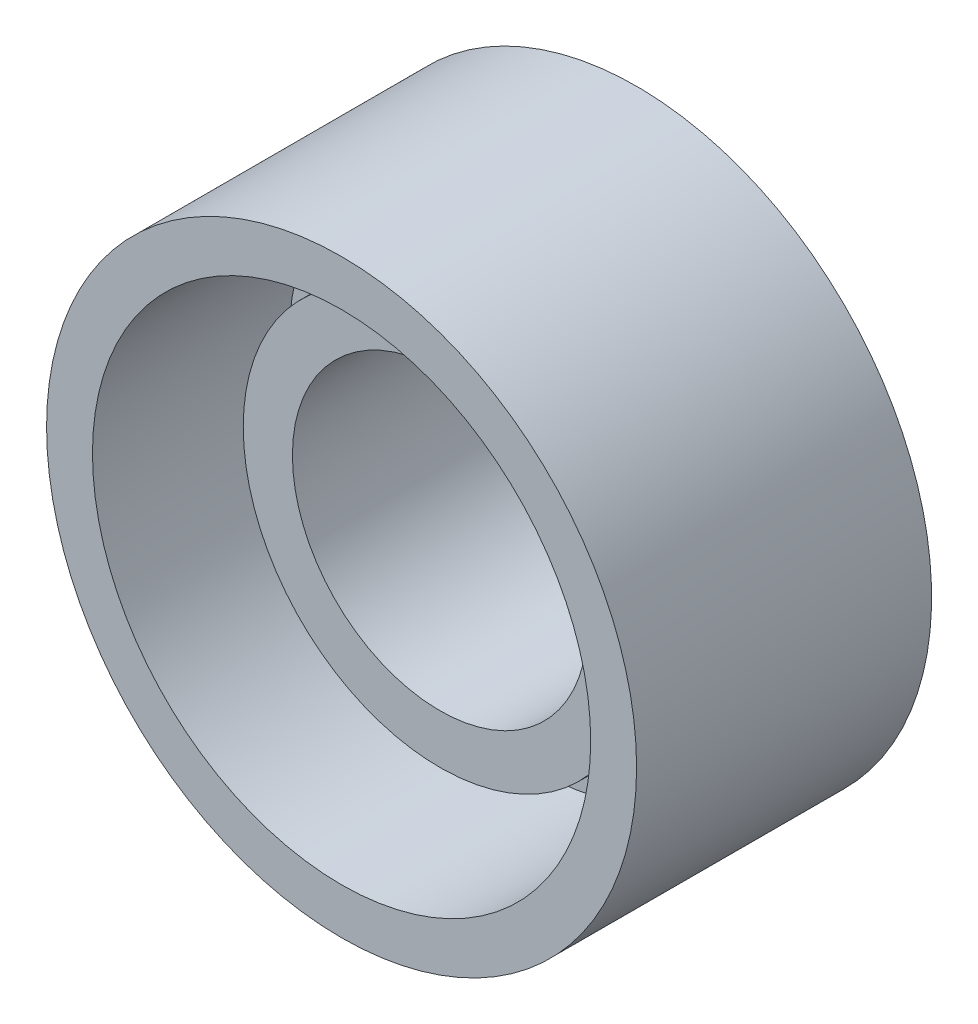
SolidWorks part; units mm, degrees
ref_plane "前视基准面" through (0, 0, 0) normal (0, 0, 1) x (1, 0, 0)
ref_plane "上视基准面" through (0, 0, 0) normal (0, 1, 0) x (1, 0, 0)
ref_plane "右视基准面" through (0, 0, 0) normal (1, 0, 0) x (0, 0, -1)
sketch "草图1" plane through (0, 0, 0) normal (0, 0, 1) x (1, 0, 0)
  circle A0 centre (0, 0) radius 45
  circle A1 centre (0, 0) radius 38
  dimension "D1" = 90
  dimension "D2" = 76
extrude "拉伸1" add sketch "草图1" along normal blind 30
sketch "草图2" plane through (0, 0, 0) normal (0, 0, -1) x (-1, 0, 0)
  circle A0 centre (0, 0) radius 30
  dimension "D1" = 60
extrude "拉伸2" add sketch "草图2" against normal blind 15
sketch "草图3" plane through (0, 0, 0) normal (0, 0, -1) x (-1, 0, 0)
  circle A0 centre (0, 0) radius 45
extrude "拉伸3" add sketch "草图3" along normal blind 15
sketch "草图4" plane through (0, 0, -15) normal (0, 0, -1) x (-1, 0, 0)
  circle A0 centre (0, 0) radius 22.5
  dimension "D1" = 45
extrude "切除-拉伸1" cut sketch "草图4" against normal through all
